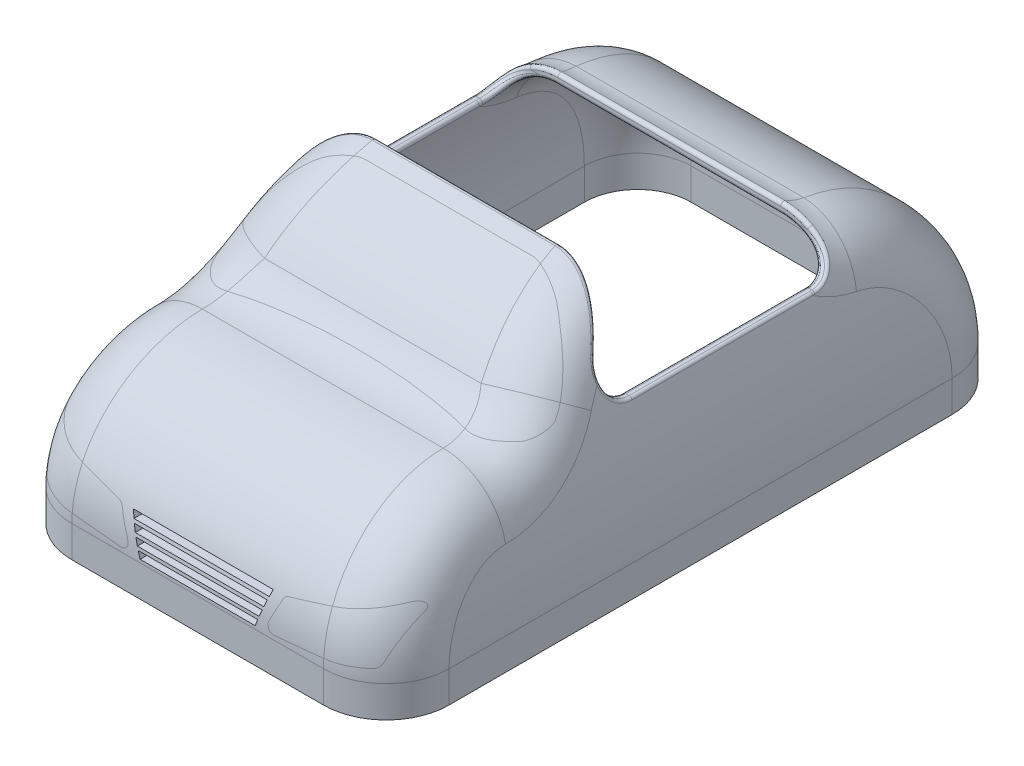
SolidWorks part; units mm, degrees
ref_plane "正面" through (0, 0, 0) normal (0, 0, 1) x (1, 0, 0)
ref_plane "平面" through (0, 0, 0) normal (0, 1, 0) x (1, 0, 0)
ref_plane "右側面" through (0, 0, 0) normal (1, 0, 0) x (0, 0, -1)
sketch "ｽｹｯﾁ1" plane through (0, 0, 0) normal (1, 0, 0) x (0, 0, -1)
  line L0 (0, 0) -> (100, 0)
  line L1 (100, 0) -> (100, 5)
  line L2 (0, 0) -> (0, 5)
  arc A0 (0, 5) -> (25, 24.3649) centre (20, 5) cw
  arc A1 (25, 24.3649) -> (75, 30) centre (51.8302, 10.9433) cw
  arc A2 (75, 30) -> (100, 5) centre (75, 5) cw
  dimension "D1" = 25
  dimension "D3" = 30
  dimension "D4" = 20
  dimension "D2" = 100
  dimension "D5" = 25
  dimension "D6" = 5
  dimension "D7" = 5
  dimension "D8" = 25
extrude "押し出し1" add sketch "ｽｹｯﾁ1" along normal mid plane 60
sketch "ｽｹｯﾁ2" plane through (0, 0, 0) normal (0, 0, 1) x (1, 0, 0)
  line L0 (-30, 0) -> (-30, 5)
  line L1 (-30, 25) -> (-30, 5) construction
  line L2 (30, 40.9433) -> (-30, 40.9433) construction
  line L3 (0, -5.514) -> (0, 45.4537) construction
  line L4 (-30, 0) -> (30, 0)
  line L5 (30, 0) -> (30, 5)
  line L6 (-20, 40.9433) -> (20, 40.9433)
  arc A0 (-30, 5) -> (-20, 40.9433) centre (39.5959, 5) cw
  arc A1 (30, 5) -> (20, 40.9433) centre (-39.5959, 5) ccw
  dimension "D1" = 40
  dimension "D2" = 5
extrude "ｶｯﾄ - 押し出し1" cut sketch "ｽｹｯﾁ2" against normal through all flip side to cut
fillet "ﾌｨﾚｯﾄ1" radius 10 12 edges at (30, 2.5, -100) (-30, 2.5, -100) (30, 2.5, 0) (-30, 2.5, 0) (28.3495, 20.0669, -94.9497) (-27.0707, 24.9788, -90.0282) (28.3594, 20.0222, -6.7965) (-27.9602, 21.7261, -9.0346) (0, 30, -75) (20.1569, 40.6818, -47.8782) (0, 24.3649, -25) (-20.0288, 40.8955, -50.1386)
shell "ｼｪﾙ1" thickness 1.5
sketch "ｽｹｯﾁ3" plane through (0, 0, 0) normal (1, 0, 0) x (0, 0, -1)
  line L0 (47.4539, 46.5709) -> (75, 46.5709)
  line L1 (75, 46.5709) -> (75, 25)
  line L2 (75, 25) -> (35, 25)
  line L3 (35, 25) -> (47.4539, 46.5709)
  line L4 (10, 0) -> (90, 0) construction
  dimension "D1" = 35
  dimension "D2" = 25
  dimension "D3" = 60
  dimension "D4" = 25
extrude "ｶｯﾄ - 押し出し2" cut sketch "ｽｹｯﾁ3" against normal through all and the other way through all
fillet "ﾌｨﾚｯﾄ2" radius 4 4 edges at (26.2752, 25, -35) (-26.2752, 25, -35) (-25.9642, 25, -75) (25.9642, 25, -75)
fillet "ﾌｨﾚｯﾄ3" radius 0.5 36 edges at (16.8376, 37.4573, -42.1922) (-16.0899, 32.7286, -33.455) (-16.0899, 33.8752, -32.4878) (19.4909, 38.1357, -42.5839) (0, 39.7717, -43.5285) (-20.8705, 30.2356, -75) (0, 30.8342, -75) (-27.0644, 25, -56.0033) (-25.4967, 25, -55.6721) (0, 37.8431, -42.415) (0, 29.1698, -75) (-18.1696, 38.8991, -43.0247) (-17.9698, 36.9627, -41.9067) (21.5253, 29.9736, -75) (27.0644, 25, -56.0033) (25.4967, 25, -55.6721) (-25.2427, 25.8087, -39.5166) (-23.7917, 29.718, -37.9932) (-25.4731, 29.6432, -37.9803) (-26.6881, 26.2137, -39.0583) (-24.5838, 26.0114, -73.6586) (-26.0827, 26.4198, -74.0565) (26.1188, 26.3742, -74.0174) (24.3059, 26.2975, -73.949) (26.8154, 25.8116, -39.5128) (25.2508, 30.1666, -38.1021) (23.8371, 29.6203, -37.9766) (25.2064, 25.9217, -39.374)
sketch "ｽｹｯﾁ4" plane through (0, 0, 0) normal (0, 0, 1) x (1, 0, 0)
  line L0 (0, 0) -> (0, 33.2978) construction
  line L1 (-9.5, 5) -> (-12, 12) construction
  line L2 (9.5, 5) -> (12, 12) construction
  line L3 (-12, 12) -> (12, 12) construction
  line L4 (-9.5, 5) -> (9.5, 5) construction
  line L5 (-9.1476, 5.5) -> (-9.5048, 6.5)
  line L6 (9.1476, 5.5) -> (9.5048, 6.5)
  line L13 (-9.1476, 5.5) -> (9.1476, 5.5)
  line L14 (-9.0291, 5.1682) -> (-11.5291, 12.1682) construction
  line L15 (20, 0) -> (-20, 0) construction
  line L17 (-9.5048, 6.5) -> (9.5048, 6.5)
  dimension "D4" = 19
  dimension "D5" = 24
  dimension "D6" = 7
  dimension "D7" = 1.5
  dimension "D3" = 5
  dimension "D2" = 1
  dimension "D1" = 0.5
extrude "ｶｯﾄ - 押し出し3" cut sketch "ｽｹｯﾁ4" against normal up to next
pattern_linear "直線ﾊﾟﾀｰﾝ2" count 4 spacing 1.5 of "ｶｯﾄ - 押し出し3"
sketch "ｽｹｯﾁ5" plane through (0, 0, 0) normal (0, 0, 1) x (1, 0, 0)
  line L0 (0, 0) -> (0, 45.4842) construction
  line L1 (-28.4705, 13.3057) -> (-26.6985, 7.6352)
  line L2 (-25.8374, 6.9379) -> (-12.2104, 5.6603)
  line L3 (-11.2052, 7.0665) -> (-12.8002, 10.6096)
  line L4 (-13.4726, 11.1701) -> (-27.2766, 14.5749)
  line L5 (20, 0) -> (-20, 0) construction
  arc A0 (-26.6985, 7.6352) -> (-25.8374, 6.9379) centre (-25.744, 7.9335) ccw
  arc A1 (-28.4705, 13.3057) -> (-27.2766, 14.5749) centre (-27.5161, 13.604) cw
  arc A2 (-12.8002, 10.6096) -> (-13.4726, 11.1701) centre (-13.7121, 10.1992) ccw
  arc A3 (-12.2104, 5.6603) -> (-11.2052, 7.0665) centre (-12.117, 6.656) ccw
  point P11 (-26.5, 7)
  point P14 (-29, 15)
  point P17 (-13, 11.0535)
  point P20 (-10.5, 5.5)
  dimension "D9" = 1
  dimension "D1" = 7
  dimension "D2" = 15
  dimension "D3" = 21
  dimension "D4" = 53
  dimension "D5" = 58
  dimension "D6" = 26
  dimension "D7" = 8.5
  dimension "D8" = 5.5
sketch "ｽｹｯﾁ6" plane through (0, 0, 0) normal (0, 0, 1) x (1, 0, 0)
  line L0 (0, -7.7058) -> (0, 32.2942) construction
  line L1 (11.2052, 7.0665) -> (12.8002, 10.6096)
  line L2 (13.4726, 11.1701) -> (27.2766, 14.5749)
  line L3 (28.4705, 13.3057) -> (26.6985, 7.6352)
  line L4 (-25.8374, 6.9379) -> (-12.2104, 5.6603)
  line L5 (-28.4705, 13.3057) -> (-26.6985, 7.6352)
  line L6 (-13.4726, 11.1701) -> (-27.2766, 14.5749)
  line L7 (-11.2052, 7.0665) -> (-12.8002, 10.6096)
  line L8 (-25.8374, 6.9379) -> (-12.2104, 5.6603) construction
  line L9 (-28.4705, 13.3057) -> (-26.6985, 7.6352) construction
  line L10 (-13.4726, 11.1701) -> (-27.2766, 14.5749) construction
  line L11 (-11.2052, 7.0665) -> (-12.8002, 10.6096) construction
  line L12 (25.8374, 6.9379) -> (12.2104, 5.6603)
  arc A0 (12.2104, 5.6603) -> (11.2052, 7.0665) centre (12.117, 6.656) cw
  arc A1 (12.8002, 10.6096) -> (13.4726, 11.1701) centre (13.7121, 10.1992) cw
  arc A2 (27.2766, 14.5749) -> (28.4705, 13.3057) centre (27.5161, 13.604) cw
  arc A3 (26.6985, 7.6352) -> (25.8374, 6.9379) centre (25.744, 7.9335) cw
  arc A4 (-26.6985, 7.6352) -> (-25.8374, 6.9379) centre (-25.744, 7.9335) ccw
  arc A5 (-27.2766, 14.5749) -> (-28.4705, 13.3057) centre (-27.5161, 13.604) ccw
  arc A6 (-12.8002, 10.6096) -> (-13.4726, 11.1701) centre (-13.7121, 10.1992) ccw
  arc A7 (-12.2104, 5.6603) -> (-11.2052, 7.0665) centre (-12.117, 6.656) ccw
  arc A8 (-26.6985, 7.6352) -> (-25.8374, 6.9379) centre (-25.744, 7.9335) ccw construction
  arc A9 (-27.2766, 14.5749) -> (-28.4705, 13.3057) centre (-27.5161, 13.604) ccw construction
  arc A10 (-12.8002, 10.6096) -> (-13.4726, 11.1701) centre (-13.7121, 10.1992) ccw construction
  arc A11 (-12.2104, 5.6603) -> (-11.2052, 7.0665) centre (-12.117, 6.656) ccw construction
  dimension "D1" = 0
sketch "ｽｹｯﾁ7" plane through (0, 0, 0) normal (0, 0, 1) x (1, 0, 0)
  line L0 (0, -4.4704) -> (0, 61.3626) construction
  line L1 (-13.2559, 38.5) -> (13.2559, 38.5)
  line L2 (20, 0) -> (-20, 0) construction
  arc A0 (-24.5998, 25.1621) -> (24.5998, 25.1621) centre (0, -193.4582) cw
  arc A1 (-25.678, 26.4132) -> (-20.1602, 35.734) centre (-6.3517, 21.266) cw
  arc A2 (25.678, 26.4132) -> (20.1602, 35.734) centre (6.3517, 21.266) ccw
  arc A3 (-24.5998, 25.1621) -> (-25.678, 26.4132) centre (-24.7117, 26.1558) cw
  arc A4 (24.5998, 25.1621) -> (25.678, 26.4132) centre (24.7117, 26.1558) ccw
  arc A5 (-20.1602, 35.734) -> (-13.2559, 38.5) centre (-13.2559, 28.5) cw
  arc A6 (20.1602, 35.734) -> (13.2559, 38.5) centre (13.2559, 28.5) ccw
  point P14 (-26, 25)
  point P17 (26, 25)
  point P20 (-16.5, 38.5)
  point P23 (16.5, 38.5)
  dimension "D5" = 20
  dimension "D6" = 220
  dimension "D7" = 1
  dimension "D8" = 10
  dimension "D1" = 52
  dimension "D2" = 25
  dimension "D3" = 13.5
  dimension "D4" = 33
